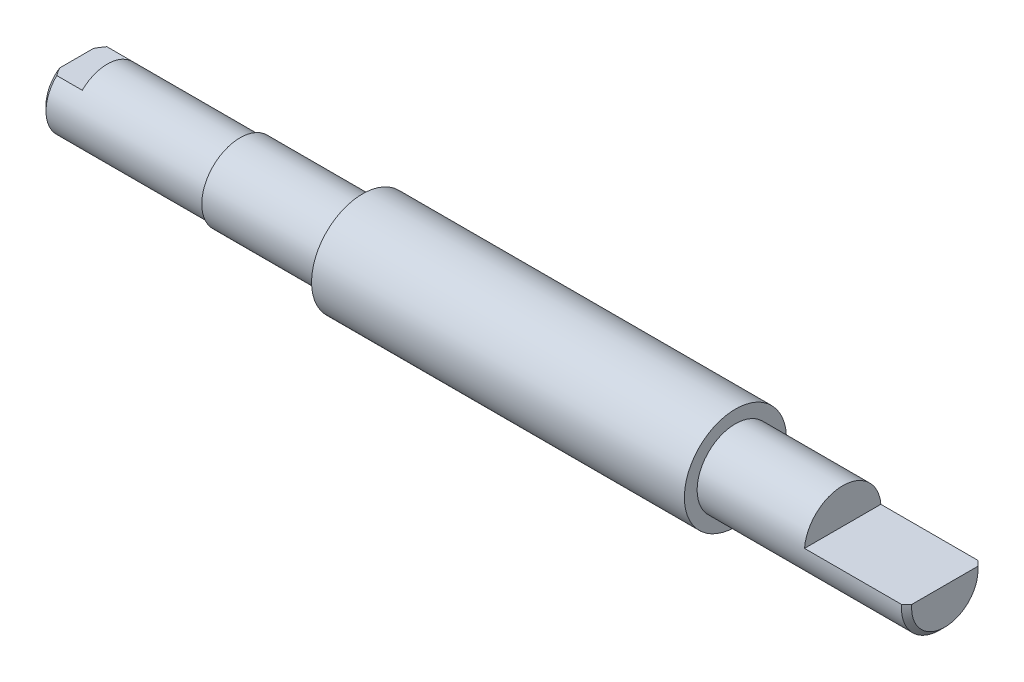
SolidWorks part; units mm, degrees
ref_plane "Plan1" through (0, 0, 0) normal (0, 0, 1) x (1, 0, 0)
ref_plane "Plan2" through (0, 0, 0) normal (0, 1, 0) x (1, 0, 0)
ref_plane "Plan3" through (0, 0, 0) normal (1, 0, 0) x (0, 0, -1)
sketch "Esquisse1" plane through (0, 0, 0) normal (0, 0, 1) x (1, 0, 0)
  line L0 (0, 0) -> (0, 7)
  line L1 (0, 7) -> (32, 7)
  line L4 (32, 7) -> (32, 7.5)
  line L5 (32, 7.5) -> (56, 7.5)
  line L6 (56, 7.5) -> (56, 10)
  line L7 (56, 10) -> (129, 10)
  line L8 (129, 10) -> (129, 7.5)
  line L11 (129, 7.5) -> (170, 7.5)
  line L12 (170, 7.5) -> (170, 0)
  line L13 (170, 0) -> (0, 0)
  line L14 (-6.0895, 0) -> (18.6267, 0) construction
  dimension "D1" = 7
  dimension "D2" = 32
  dimension "D3" = 7.5
  dimension "D4" = 7.5
  dimension "D5" = 41
  dimension "D6" = 10
  dimension "D9" = 24
  dimension "D12" = 170
revolve "Base-Révolution" add sketch "Esquisse1" angle 360 about L14
chamfer "Chanfrein1" distance 1 angle 45
ref_plane "Plan4" through (0, 0.6, 0) normal (0, 1, 0) x (-1, 0, 0)
sketch "Esquisse2" plane through (0, 0.6, 0) normal (0, 1, 0) x (-1, 0, 0)
  line L1 (-150, 12.3148) -> (-203.4829, 12.3148)
  line L2 (-150, 12.3148) -> (-150, -9.3376)
  line L3 (-150, -9.3376) -> (-203.4829, -9.3376)
  line L4 (-203.4829, 12.3148) -> (-203.4829, -9.3376)
  line L5 (-170, 6.5) -> (-170, -6.5) construction
  dimension "D1" = 20
extrude "Enlèv. mat.-Extru.1" cut sketch "Esquisse2" along normal up to next
sketch "Esquisse3" plane through (0, 0, 0) normal (-1, 0, 0) x (0, 0, 1)
  line L0 (11.3489, 0) -> (-10.6926, 0) construction
  line L1 (8.0291, -5) -> (-8.5309, -5)
  line L2 (8.0291, -5) -> (8.0291, -11.0218)
  line L3 (8.0291, -11.0218) -> (-8.5309, -11.0218)
  line L4 (-8.5309, -5) -> (-8.5309, -11.0218)
  line L5 (-8.5309, 5) -> (-8.5309, 11.0218)
  line L6 (8.0291, 11.0218) -> (-8.5309, 11.0218)
  line L7 (8.0291, 5) -> (8.0291, 11.0218)
  line L8 (8.0291, 5) -> (-8.5309, 5)
  dimension "D1" = 5
extrude "Enlèv. mat.-Extru.2" cut sketch "Esquisse3" against normal blind 6
